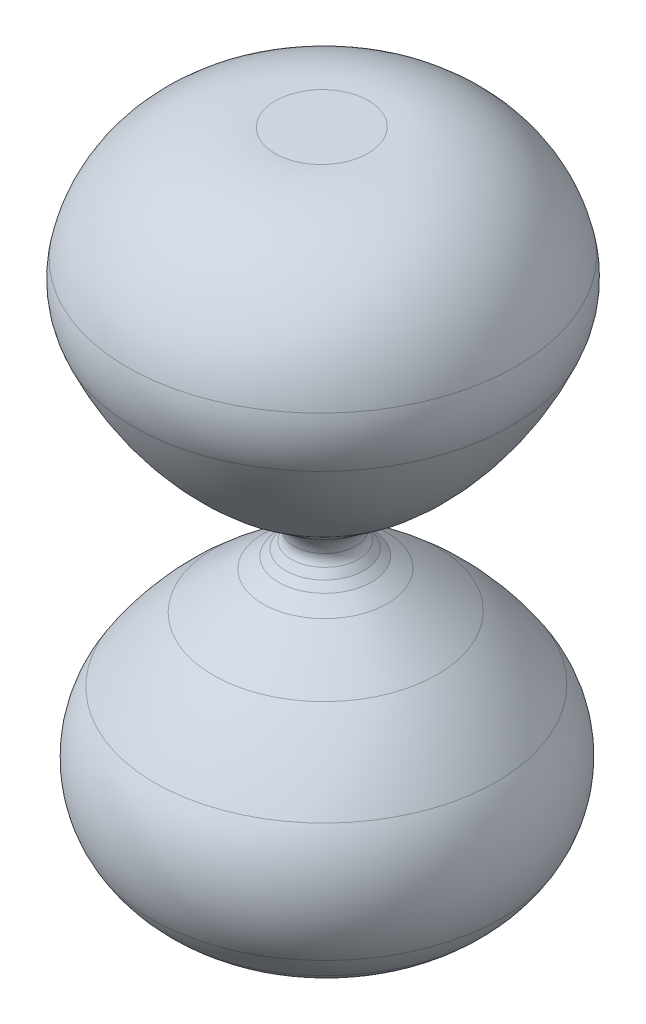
SolidWorks part; units mm, degrees
ref_plane "Front Plane" through (0, 0, 0) normal (0, 0, 1) x (1, 0, 0)
ref_plane "Top Plane" through (0, 0, 0) normal (0, 1, 0) x (1, 0, 0)
ref_plane "Right Plane" through (0, 0, 0) normal (1, 0, 0) x (0, 0, -1)
sketch "Sketch1" plane through (0, 0, 0) normal (0, 0, 1) x (1, 0, 0)
  line L0 (0.0053, 121.3221) -> (8.7304, 121.3221)
  line L1 (19.1602, 67.8831) -> (8.7304, 60.0031)
  line L11 (1.1656, -2.1219) -> (0.0053, 121.3221) construction
  line L13 (-33.8963, 99.8869) -> (36.6618, 100.5501) construction
  line L14 (-33.9025, 17.4587) -> (0, 17.4587) construction
  line L15 (6.9331, 54.2111) -> (8.0096, 52.8933)
  line L16 (8.0096, 52.8933) -> (9.3736, 51.6942)
  line L17 (9.3736, 51.6942) -> (12.3458, 49.6747)
  line L18 (20.2823, -2.1219) -> (1.1656, -2.1219)
  line L19 (1.1656, -2.1219) -> (0.0053, 121.3221) construction
  line L20 (0.0053, 121.3221) -> (1.1656, -2.1219)
  arc A1 (8.7304, 121.3221) -> (36.6618, 100.5501) centre (10.7646, 94.8924) cw
  arc A2 (36.6618, 100.5501) -> (35.713, 90.364) centre (20.176, 96.9485) cw
  arc A3 (35.713, 90.364) -> (19.1602, 67.8831) centre (-19.7558, 113.8713) cw
  arc A4 (8.7304, 60.0031) -> (6.4133, 56.0983) centre (12.3458, 55.2178) ccw
  arc A5 (6.4133, 56.0983) -> (6.9331, 54.2111) centre (8.8082, 55.7429) ccw
  arc A6 (12.3458, 49.6747) -> (21.7346, 42.7909) centre (-78.9419, -84.6778) cw
  arc A7 (21.7346, 42.7909) -> (32.8863, 30.8772) centre (-12.1233, -0.0773) cw
  arc A9 (32.8863, 30.8772) -> (33.8715, 9.1143) centre (15.9143, 19.2051) cw
  arc A10 (33.8715, 9.1143) -> (29.6905, 3.6702) centre (12.8694, 20.9161) cw
  arc A11 (29.6905, 3.6702) -> (22.6077, -1.3161) centre (10.6529, 23.1887) cw
  arc A12 (22.6077, -1.3161) -> (20.2823, -2.1219) centre (18.1131, 7.8968) cw
  dimension "D1" = 123.444
  dimension "D2" = 70.5612
revolve "Revolve7" add sketch "Sketch1" angle 360 about L20
